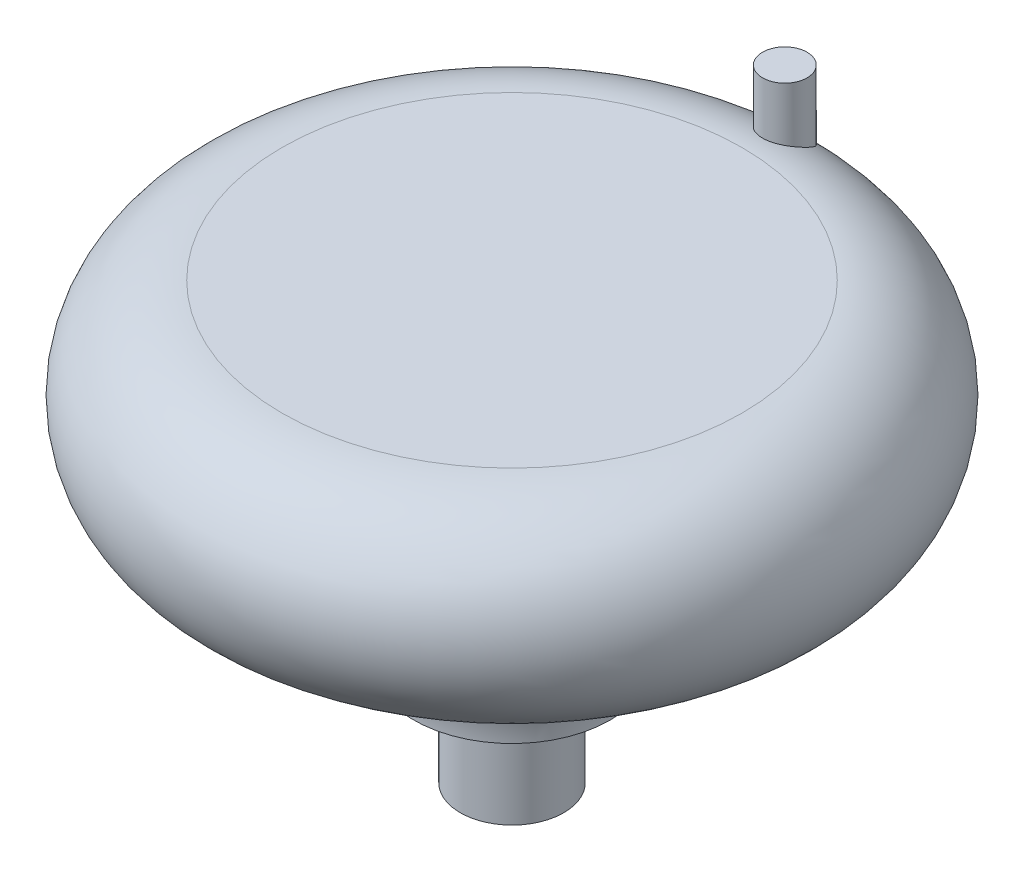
SolidWorks part; units mm, degrees
ref_plane "Ebene vorne" through (0, 0, 0) normal (0, 0, 1) x (1, 0, 0)
ref_plane "Ebene oben" through (0, 0, 0) normal (0, 1, 0) x (1, 0, 0)
ref_plane "Ebene rechts" through (0, 0, 0) normal (1, 0, 0) x (0, 0, -1)
sketch "Skizze1" plane through (0, 0, 0) normal (0, 0, 1) x (1, 0, 0)
  line L0 (11.0998, 22.35) -> (0, 22.35)
  line L1 (0, 22.35) -> (0, 6.35)
  line L2 (0, 6.35) -> (4.75, 6.35)
  line L3 (0, 22.35) -> (0, 6.35) construction
  line L4 (0, 0) -> (0, 30.0007) construction
  arc A0 (4.75, 6.35) -> (11.0998, 12.75) centre (11.0998, 6.4) cw
  arc A1 (11.0998, 12.75) -> (11.0998, 22.35) centre (11.0998, 17.55) ccw
  dimension "D3" = 6.35
  dimension "D4" = 4.8
  dimension "D1" = 9.5
  dimension "D2" = 6.35
  dimension "D5" = 16
revolve "Rotation1" add sketch "Skizze1" angle 360 about L3
sketch "Skizze2" plane through (0, 6.35, 0) normal (0, -1, 0) x (1, 0, 0)
  circle A0 centre (0, 0) radius 2.5
  dimension "D1" = 5
extrude "Linear austragen1" add sketch "Skizze2" along normal blind 5
ref_plane "Ebene1" through (5.7903, 0, -3.4524) normal (0.8589, 0, -0.5121) x (0, 1, 0)
sketch "Skizze3" plane through (5.7903, 0, -3.4524) normal (0.8589, 0, -0.5121) x (0, 1, 0)
  line L0 (24.765, -12.3804) -> (24.765, -11.3067)
  line L1 (24.765, -11.3067) -> (21.0563, -11.3067)
  line L2 (21.0563, -11.3067) -> (21.0563, -12.3804)
  line L3 (21.0563, -12.3804) -> (24.765, -12.3804)
  line L4 (24.765, -11.3067) -> (21.0563, -11.3067) construction
revolve "Rotation2" add sketch "Skizze3" angle 360 about L4
